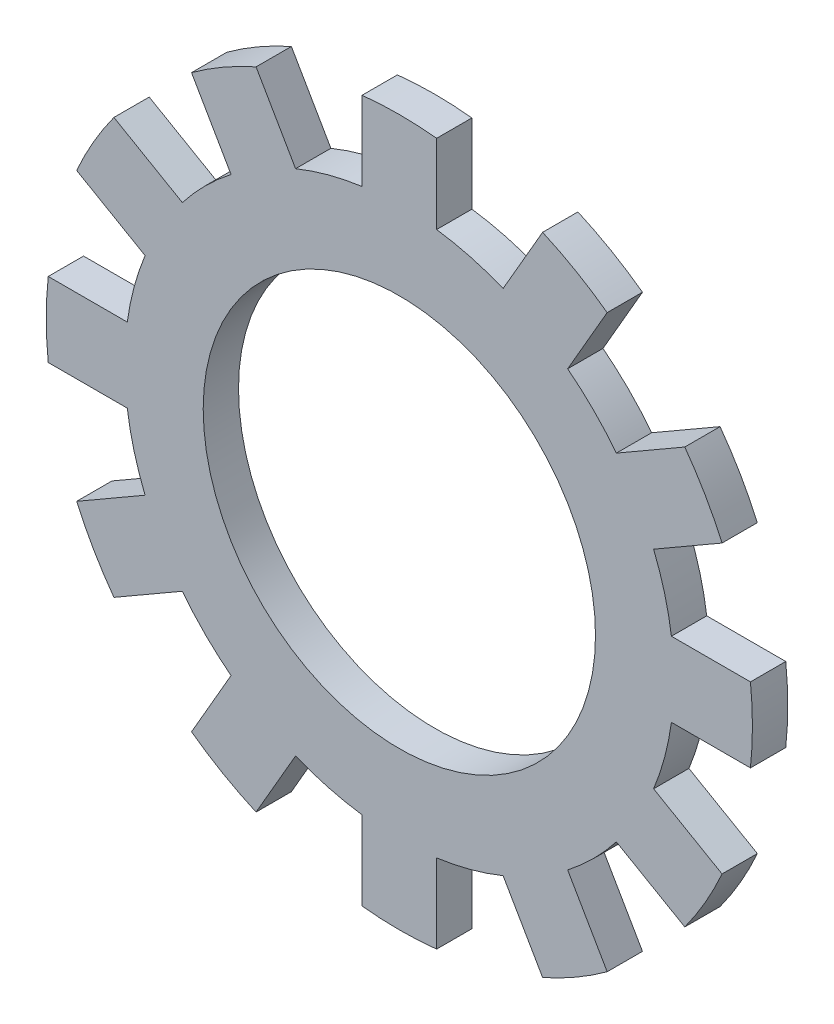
SolidWorks part; units mm, degrees
ref_plane "Front Plane" through (0, 0, 0) normal (0, 0, 1) x (1, 0, 0)
ref_plane "Top Plane" through (0, 0, 0) normal (0, 1, 0) x (1, 0, 0)
ref_plane "Right Plane" through (0, 0, 0) normal (1, 0, 0) x (0, 0, -1)
sketch "Sketch1" plane through (0, 0, 0) normal (0, 0, 1) x (1, 0, 0)
  circle A0 centre (0, 0) radius 5
  circle A1 centre (0, 0) radius 7
  dimension "D1" = 10
  dimension "D2" = 14
extrude "Boss-Extrude1" add sketch "Sketch1" along normal mid plane 0.9
sketch "Sketch2" plane through (0, 0, 0) normal (0, 0, 1) x (1, 0, 0)
  line L0 (0, 2.6811) -> (0, -2.8425) construction
sketch "Sketch3" plane through (0, 0, 0) normal (0, 0, 1) x (1, 0, 0)
  line L0 (-0.95, 8.9497) -> (-0.95, 6.9352)
  line L2 (0, 2.6811) -> (0, -2.8425) construction
  line L3 (0, 7) -> (0, 9)
  arc A0 (0, 9) -> (-0.95, 8.9497) centre (0, 0) ccw
  arc A1 (0, 7) -> (-0.95, 6.9352) centre (0, 0) ccw
  circle A2 centre (0, 0) radius 7 construction
  dimension "D2" = 9
  dimension "D1" = 0.95
extrude "Boss-Extrude2" add sketch "Sketch3" along normal mid plane 0.9
mirror "Mirror1" about plane through (0, 0, 0) normal (1, 0, 0) of "Boss-Extrude2"
pattern_circular "CirPattern2" count 12 over 360 about axis through (0, 0, 0) along (0, 0, 1) of "Boss-Extrude2", "Mirror1"
